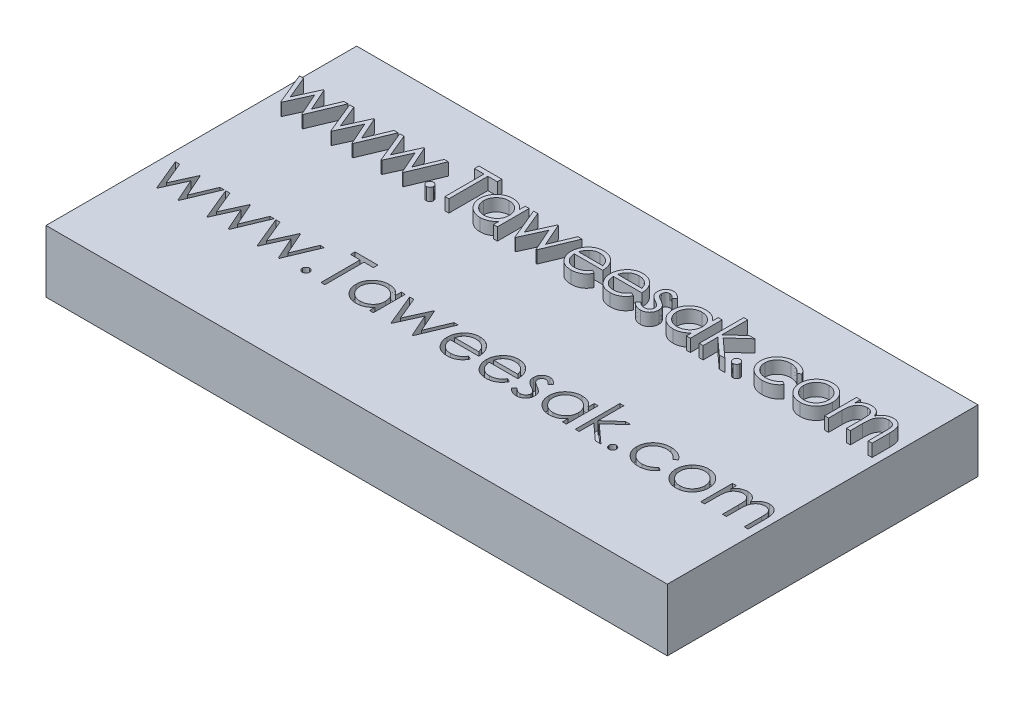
SolidWorks part; units mm, degrees
ref_plane "Front Plane" through (0, 0, 0) normal (0, 0, 1) x (1, 0, 0)
ref_plane "Top Plane" through (0, 0, 0) normal (0, 1, 0) x (1, 0, 0)
ref_plane "Right Plane" through (0, 0, 0) normal (1, 0, 0) x (0, 0, -1)
sketch "Sketch1" plane through (0, 0, 0) normal (0, 1, 0) x (1, 0, 0)
  line L1 (0, 0) -> (100, 0)
  line L2 (0, 0) -> (0, 50)
  line L3 (0, 50) -> (100, 50)
  line L4 (100, 0) -> (100, 50)
  dimension "D1" = 100
  dimension "D2" = 50
extrude "Extrude1" add sketch "Sketch1" along normal blind 10
sketch "Sketch3" plane through (0, 10, 0) normal (0, 1, 0) x (-1, 0, 0)
  line L0 (0, -34.1319) -> (-100, -34.1319) construction
  line L1 (0, -50) -> (0, 0) construction
  line L2 (-100, 0) -> (-100, -50) construction
  line L3 (-100, -50) -> (0, -50) construction
  line L4 (0, -11.3002) -> (-100, -11.3002) construction
  text T0 "www.Taweesak.com" font "Century Gothic" height 7
extrude "Extrude2" add sketch "Sketch3" along normal blind 2
sketch "Sketch4" plane through (0, 10, 0) normal (0, 1, 0) x (-1, 0, 0)
  line L0 (0, -14.1842) -> (-100, -14.1842) construction
  line L1 (0, -50) -> (0, 0) construction
  line L2 (-100, 0) -> (-100, -50) construction
  text T0 "www.Taweesak.com" font "Century Gothic" height 7
extrude "Cut-Extrude1" cut sketch "Sketch4" against normal blind 2
